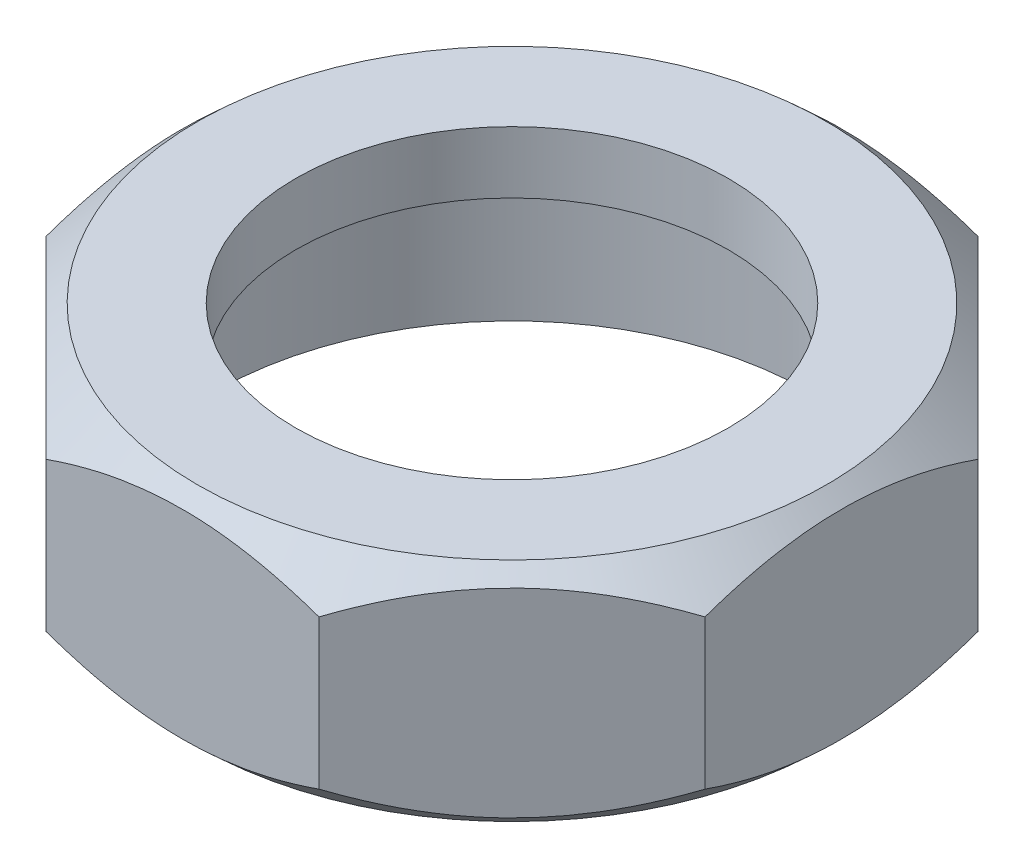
SolidWorks part; units mm, degrees
ref_plane "Front Plane" through (0, 0, 0) normal (0, 0, 1) x (1, 0, 0)
ref_plane "Top Plane" through (0, 0, 0) normal (0, 1, 0) x (1, 0, 0)
ref_plane "Right Plane" through (0, 0, 0) normal (1, 0, 0) x (0, 0, -1)
sketch "Sketch1" plane through (0, 0, 0) normal (0, 1, 0) x (1, 0, 0)
  line L1 (6.6274, 16) -> (-6.6274, 16)
  line L2 (-6.6274, 16) -> (-16, 6.6274)
  line L3 (-16, 6.6274) -> (-16, -6.6274)
  line L4 (-16, -6.6274) -> (-6.6274, -16)
  line L5 (-6.6274, -16) -> (6.6274, -16)
  line L6 (6.6274, -16) -> (16, -6.6274)
  line L7 (16, -6.6274) -> (16, 6.6274)
  line L8 (16, 6.6274) -> (6.6274, 16)
  circle A0 centre (0, 0) radius 10.5
  circle A1 centre (0, 0) radius 16 construction
  dimension "D1" = 21
  dimension "D2" = 32
extrude "Boss-Extrude1" add sketch "Sketch1" along normal mid plane 11
sketch "Sketch3" plane through (0, 0, 0) normal (0, 0, 1) x (1, 0, 0)
  line L0 (0, 0) -> (0, 11.5948) construction
  line L1 (0, 0) -> (-21.4885, 0) construction
  line L2 (-18.5, 2.5344) -> (-18.5, 7.5)
  line L3 (-18.5, 7.5) -> (-13.1, 7.5)
  line L4 (-13.1, 7.5) -> (-18.5, 2.5344)
  line L5 (-16, 5.5) -> (-6.6274, 5.5) construction
  line L6 (-18.5, -7.5) -> (-13.1, -7.5)
  line L7 (-18.5, -2.5344) -> (-18.5, -7.5)
  line L8 (-13.1, -7.5) -> (-18.5, -2.5344)
  point P5 (0, 0)
  dimension "D1" = 5.4
  dimension "D2" = 7.5
  dimension "D3" = 18.5
  dimension "D4" = 137.4
revolve "Cut-Revolve1" cut sketch "Sketch3" angle 360 about L0
sketch "Sketch4" plane through (0, -5.5, 0) normal (0, -1, 0) x (1, 0, 0)
  circle A0 centre (0, 0) radius 14.5
  dimension "D1" = 29
extrude "Cut-Extrude1" cut sketch "Sketch4" against normal blind 8
